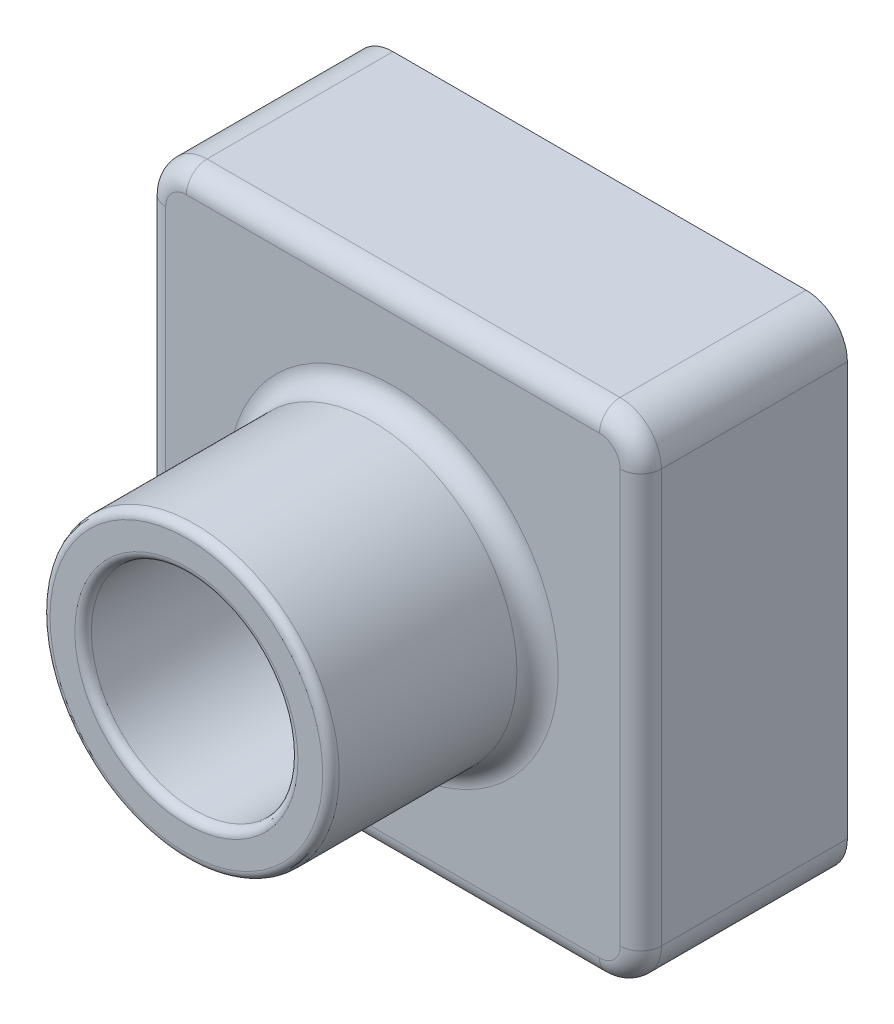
SolidWorks part; units mm, degrees
ref_plane "Front Plane" through (0, 0, 0) normal (0, 0, 1) x (1, 0, 0)
ref_plane "Top Plane" through (0, 0, 0) normal (0, 1, 0) x (1, 0, 0)
ref_plane "Right Plane" through (0, 0, 0) normal (1, 0, 0) x (0, 0, -1)
sketch "Sketch1" plane through (0, 0, 0) normal (0, 0, 1) x (1, 0, 0)
  line L1 (0, 0) -> (120, 0)
  line L2 (0, 0) -> (0, 120)
  line L3 (0, 120) -> (120, 120)
  line L4 (120, 0) -> (120, 120)
  dimension "D1" = 120
  dimension "D2" = 120
extrude "Extrude1" add sketch "Sketch1" along normal blind 50
sketch "Sketch2" plane through (0, 0, 50) normal (0, 0, 1) x (1, 0, 0)
  line L0 (120, 120) -> (0, 120) construction
  line L1 (120, 0) -> (120, 120) construction
  circle A0 centre (60, 60) radius 35
  dimension "D3" = 70
  dimension "D1" = 60
  dimension "D2" = 60
extrude "Extrude2" add sketch "Sketch2" along normal blind 50
sketch "Sketch3" plane through (0, 0, 100) normal (0, 0, 1) x (1, 0, 0)
  circle A0 centre (60, 60) radius 25
  circle A1 centre (60, 60) radius 35 construction
  dimension "D1" = 50
extrude "Cut-Extrude1" cut sketch "Sketch3" against normal through all
fillet "Fillet1" radius 10 4 edges at (120, 120, 25) (120, 0, 25) (0, 0, 25) (0, 120, 25)
fillet "Fillet2" radius 5 9 edges at (25, 60, 50) (117.0711, 2.9289, 50) (60, 0, 50) (2.9289, 2.9289, 50) (0, 60, 50) (2.9289, 117.0711, 50) (60, 120, 50) (117.0711, 117.0711, 50) (120, 60, 50)
fillet "Fillet3" radius 2 2 edges at (95, 60, 100) (85, 60, 100)
shell "Shell1" thickness 2
